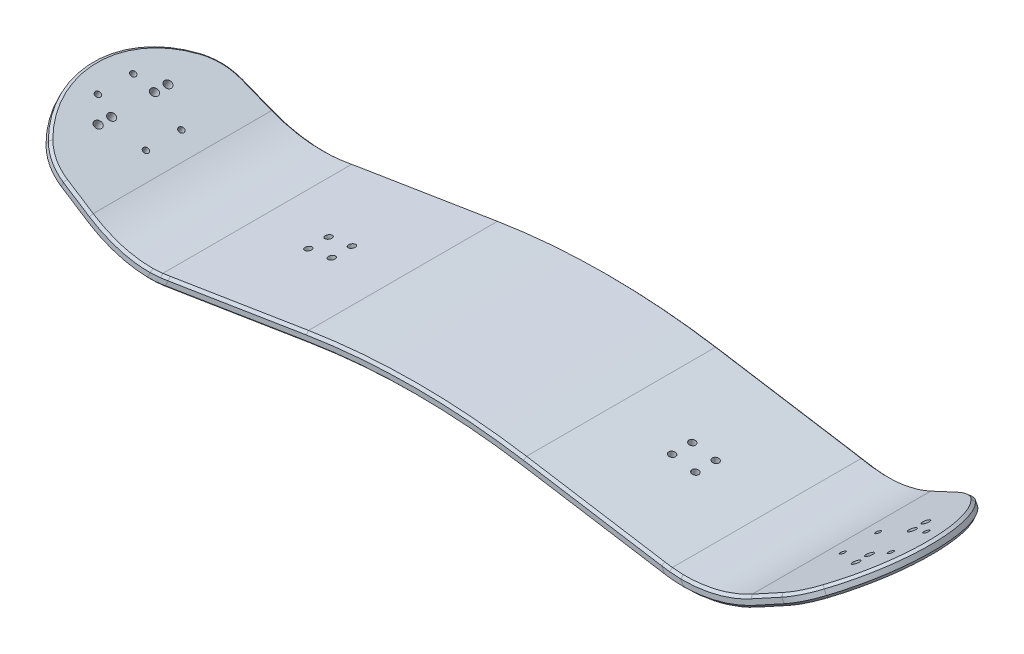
SolidWorks part; units mm, degrees
ref_plane "Front Plane" through (0, 0, 0) normal (0, 0, 1) x (1, 0, 0)
ref_plane "Top Plane" through (0, 0, 0) normal (0, 1, 0) x (1, 0, 0)
ref_plane "Right Plane" through (0, 0, 0) normal (1, 0, 0) x (0, 0, -1)
sketch "Sketch1" plane through (0, 0, 0) normal (0, 0, 1) x (1, 0, 0)
  line L0 (-500, 0) -> (500, 0) construction
  line L1 (0, 0) -> (0, 51.2701) construction
  line L2 (-500, 0) -> (-500, 70) construction
  line L3 (500, 0) -> (500, 70) construction
  line L4 (-500, 70) -> (-396.1345, 17.0779)
  line L5 (500, 70) -> (396.1345, 17.0779)
  line L6 (-300.0895, 1.9928) -> (-127.3152, 29.8148)
  line L7 (300.0895, 1.9928) -> (127.3152, 29.8148)
  arc A0 (-396.1345, 17.0779) -> (-300.0895, 1.9928) centre (-325, 156.6872) ccw
  arc A1 (396.1345, 17.0779) -> (300.0895, 1.9928) centre (325, 156.6872) cw
  arc A2 (-127.3152, 29.8148) -> (127.3152, 29.8148) centre (0, -760.8128) cw
  point P7 (-325, 0)
  point P8 (325, 0)
  dimension "D6" = 40
  dimension "D1" = 1000
  dimension "D2" = 70
  dimension "D3" = 650
  dimension "D4" = 27
  dimension "D5" = 175
extrude "Extrude-Thin1" add sketch "Sketch1" along normal mid plane 230 thin
sketch "Sketch2" plane through (69.2902, -135.9897, 0) normal (-0.454, 0.891, 0) x (0.891, 0.454, 0)
  line L0 (477.2826, 0) -> (331.9036, 0) construction
  line L1 (477.2826, -115) -> (477.2826, 115) construction
  line L2 (275.3649, 115) -> (398.4876, 106)
  line L3 (360.7116, 115) -> (275.3649, 115) construction
  line L4 (275.3649, -115) -> (398.4876, -106)
  line L6 (477.2826, 115) -> (360.7116, 115) construction
  arc A0 (398.4876, 106) -> (436.8453, 89.8319) centre (393.7488, 41.173) cw
  arc A1 (398.4876, -106) -> (436.8453, -89.8319) centre (393.7488, -41.173) ccw
  arc A2 (436.8453, 89.8319) -> (436.8453, -89.8319) centre (357.2826, 0) cw
  dimension "D2" = 65
  dimension "D3" = 120
  dimension "D1" = 9
extrude "Cut-Extrude1" cut sketch "Sketch2" against normal through all and the other way through all flip side to cut
mirror "Mirror1" about plane through (0, 0, 0) normal (1, 0, 0) of "Cut-Extrude1"
fillet "Fillet1" radius 250 4 edges at (-305.3043, 7.3498, -115) (305.3043, 7.3498, -115) (305.3043, 7.3498, 115) (-305.3043, 7.3498, 115)
chamfer "Chamfer1" distance 3 angle 45 56 edges at (0, 40, -115) (212.4512, 16.1053, -115) (-212.4512, 16.1053, -115) (298.8384, 2.1943, -114.9979) (-298.8384, 2.1943, -114.9979) (358.7555, 3.6792, -111.6405) (-358.7555, 3.6792, -111.6405) (412.9638, 25.6528, -107.3807) (-412.9638, 25.6528, -107.3807) (448.066, 43.5383, -101.0695) (-448.066, 43.5383, -101.0695) (500, 70, 0) (-500, 70, 0) (448.066, 43.5383, 101.0695) (-448.066, 43.5383, 101.0695) (412.9638, 25.6528, 107.3807) (-412.9638, 25.6528, 107.3807) (358.7555, 3.6792, 111.6405) (-358.7555, 3.6792, 111.6405) (298.8384, 2.1943, 114.9979) (-298.8384, 2.1943, 114.9979) (212.4512, 16.1053, 115) (-212.4512, 16.1053, 115) (0, 40, 115) (0, 52, -115) (210.0318, 28.6495, -115) (-210.0318, 28.6495, -115) (296.4199, 14.7384, -114.9583) (-296.4199, 14.7384, -114.9583) (352.8542, 14.7065, -111.6589) (-352.8542, 14.7065, -111.6589) (407.5159, 36.3449, -107.3807) (-407.5159, 36.3449, -107.3807) (442.6181, 54.2304, -101.0695) (-442.6181, 54.2304, -101.0695) (494.5521, 80.6921, 0) (-494.5521, 80.6921, 0) (442.6181, 54.2304, 101.0695) (-442.6181, 54.2304, 101.0695) (407.5159, 36.3449, 107.3807) (-407.5159, 36.3449, 107.3807) (352.8542, 14.7065, 111.6589) (-352.8542, 14.7065, 111.6589) (296.4199, 14.7384, 114.9583) (-296.4199, 14.7384, 114.9583) (210.0318, 28.6495, 115) (-210.0318, 28.6495, 115) (0, 52, 115)
sketch "Sketch3" plane through (9.8055, 60.892, 0) normal (0.159, 0.9873, 0) x (0.9873, -0.159, 0)
  line L0 (120.9559, 0) -> (295.9559, -0.0035) construction
  line L1 (120.9559, -112) -> (120.9559, 112) construction
  line L2 (295.9559, -111.8905) -> (295.9559, 111.8835) construction
  line L3 (208.4559, -0.0017) -> (208.4559, 69.8299) construction
  circle A0 centre (222.4559, 11.998) radius 4
  circle A1 centre (222.4555, -12.002) radius 4
  circle A2 centre (194.4564, -12.002) radius 4
  circle A3 centre (194.4559, 11.998) radius 4
  dimension "D1" = 28
  dimension "D2" = 24
  dimension "D3" = 8
extrude "Binding Holes" cut sketch "Sketch3" against normal through all
sketch "Sketch4" plane through (-9.8055, 60.892, 0) normal (-0.159, 0.9873, 0) x (0.9873, 0.159, 0)
  line L0 (-295.9559, 0.0035) -> (-120.9559, 0) construction
  line L3 (-208.4559, 0.0017) -> (-208.4559, 26.2678) construction
  line L4 (-295.9559, -111.8835) -> (-295.9559, 111.8905) construction
  line L5 (-120.9559, -112) -> (-120.9559, 112) construction
  circle A0 centre (-194.4559, 12.0015) radius 4
  circle A1 centre (-194.4564, -11.9985) radius 4
  circle A2 centre (-222.4555, -11.9985) radius 4
  circle A3 centre (-222.4559, 12.0015) radius 4
  dimension "D1" = 28
  dimension "D2" = 24
  dimension "D3" = 8
extrude "Cut-Extrude2" cut sketch "Sketch4" against normal through all
hole_wizard "M6 Clearance Hole1" positions "Sketch6" profile "Sketch5" hole size "M6" standard "Ansi Metric"
sketch "Sketch6" plane through (69.2902, -135.9897, 0) normal (-0.454, 0.891, 0) x (-0.891, -0.454, 0)
  line L0 (-360.7116, 0) -> (-474.2826, 0) construction
  line L1 (-360.7116, 105.7533) -> (-360.7116, -105.7533) construction
  arc A0 (-434.8562, 87.5861) -> (-434.8562, -87.5861) centre (-357.2826, 0) ccw construction
  point P0 (-449.7116, 21)
  point P1 (-385.7116, 21)
  point P12 (-449.7116, -21)
  point P13 (-385.7116, -21)
  dimension "D1" = 64
  dimension "D2" = 25
  dimension "D3" = 42
sketch "Sketch5" plane through (469.9862, 68.1751, 21) normal (0, 0, 1) x (-0.891, -0.454, 0)
  line L0 (0, 0) -> (0, 76.722)
  line L1 (0, 76.722) -> (3.3, 76.722)
  line L2 (3.3, 76.722) -> (3.3, 0)
  line L5 (3.3, 0) -> (0, 0)
  line L11 (0, -6.35) -> (0, 107.95) construction
  dimension "Thru Hole Dia." = 6.6
  dimension "Thru Hole Depth" = 76.722
hole_wizard "M8 Clearance Hole1" positions "Sketch9" profile "Sketch8" hole size "M8" standard "Ansi Metric"
sketch "Sketch9" plane through (69.2902, -135.9897, 0) normal (-0.454, 0.891, 0) x (-0.891, -0.454, 0)
  line L0 (-360.7116, 0) -> (-474.2826, 0) construction
  line L1 (-360.7116, 105.7533) -> (-360.7116, -105.7533) construction
  arc A0 (-434.8562, 87.5861) -> (-434.8562, -87.5861) centre (-357.2826, 0) ccw construction
  circle A1 centre (-385.7116, -21) radius 3.3 construction
  point P0 (-426.4246, -25.35)
  point P1 (-426.4246, -41.35)
  point P12 (-426.4246, 41.35)
  point P13 (-426.4246, 25.35)
  dimension "D1" = 40.713
  dimension "D2" = 16
  dimension "D3" = 50.7
sketch "Sketch8" plane through (449.2373, 57.603, -25.35) normal (0, 0, 1) x (-0.891, -0.454, 0)
  line L0 (0, 0) -> (0, 76.722)
  line L1 (0, 76.722) -> (4.5, 76.722)
  line L2 (4.5, 76.722) -> (4.5, 0)
  line L5 (4.5, 0) -> (0, 0)
  line L11 (0, -6.35) -> (0, 107.95) construction
  dimension "Thru Hole Dia." = 9
  dimension "Thru Hole Depth" = 76.722
mirror "Mirror2" about plane through (0, 0, 0) normal (1, 0, 0) of "M6 Clearance Hole1", "M8 Clearance Hole1"
sketch "Sketch10" [suppressed] plane through (0, 0, 0) normal (0, 1, 0) x (1, 0, 0)
  line L0 (-129.223, 115) -> (-290.8406, 115) construction
  line L1 (-500, 115) -> (0, 115)
  line L2 (-500, 115) -> (-500, -115)
  line L3 (-500, -115) -> (0, -115)
  line L4 (0, 115) -> (0, -115)
  line L5 (-129.223, -115) -> (-290.8406, -115) construction
  ellipse E0 centre (-393.0792, 0) end of major axis (-393.0792, 120) minor radius 106.9208 (-463.9701, 89.8319) -> (-463.9701, -89.8319) ccw construction
extrude "Cut-Extrude4" [suppressed] cut sketch "Sketch10" along normal through all
sketch "Sketch11" [suppressed] plane through (9.8055, 60.892, 0) normal (0.159, 0.9873, 0) x (0.9873, -0.159, 0)
  line L0 (132.9559, 70.5069) -> (216.3601, -103)
  line L1 (132.9559, 70.5069) -> (200.5518, 103)
  line L2 (216.3601, -103) -> (283.9559, -70.5069)
  line L3 (200.5518, 103) -> (283.9559, -70.5069)
  line L4 (120.9559, -112) -> (120.9559, 112) construction
  line L5 (284.6555, 115) -> (120.9559, 115) construction
  line L6 (295.9559, -111.8905) -> (295.9559, 111.8835) construction
  line L7 (284.6555, -115) -> (120.9559, -115) construction
  dimension "D1" = 12
  dimension "D2" = 12
  dimension "D3" = 75
  dimension "D4" = 12
  dimension "D5" = 12
sketch "Sketch12" [suppressed] plane through (74.7381, -146.6818, 0) normal (0.454, -0.891, 0) x (0.891, 0.454, 0)
  line L0 (360.7116, 105.7533) -> (360.7116, -105.7533) construction
  circle A0 centre (410.7116, 0) radius 37.5
  dimension "D1" = 75
  dimension "D2" = 50
